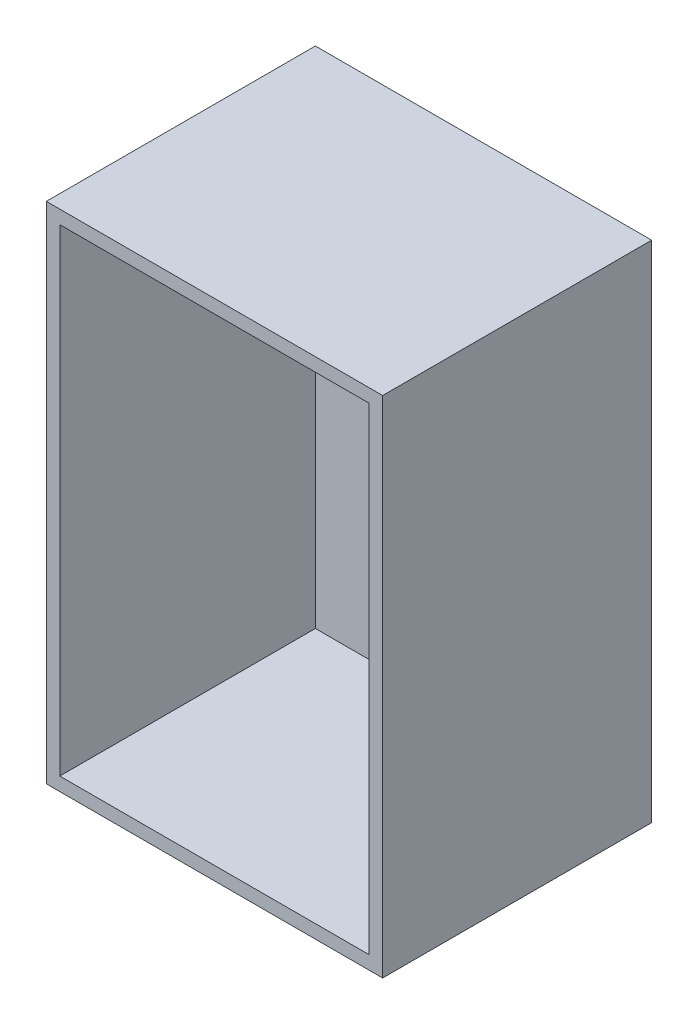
SolidWorks part; units mm, degrees
ref_plane "Płaszczyzna przednia" through (0, 0, 0) normal (0, 0, 1) x (1, 0, 0)
ref_plane "Płaszczyzna górna" through (0, 0, 0) normal (0, 1, 0) x (1, 0, 0)
ref_plane "Płaszczyzna prawa" through (0, 0, 0) normal (1, 0, 0) x (0, 0, -1)
sketch "Szkic1" plane through (0, 0, 0) normal (0, 0, 1) x (1, 0, 0)
  line L1 (50, -75) -> (-50, -75)
  line L2 (50, -75) -> (50, 75)
  line L3 (50, 75) -> (-50, 75)
  line L4 (-50, -75) -> (-50, 75)
  line L5 (50, -75) -> (-50, 75) construction
  line L6 (50, 75) -> (-50, -75) construction
  point P0 (0, 0)
  dimension "D1" = 100
  dimension "D2" = 150
extrude "Dodanie-wyciągnięcie1" add sketch "Szkic1" along normal mid plane 80
shell "Skorupa1" thickness 4
